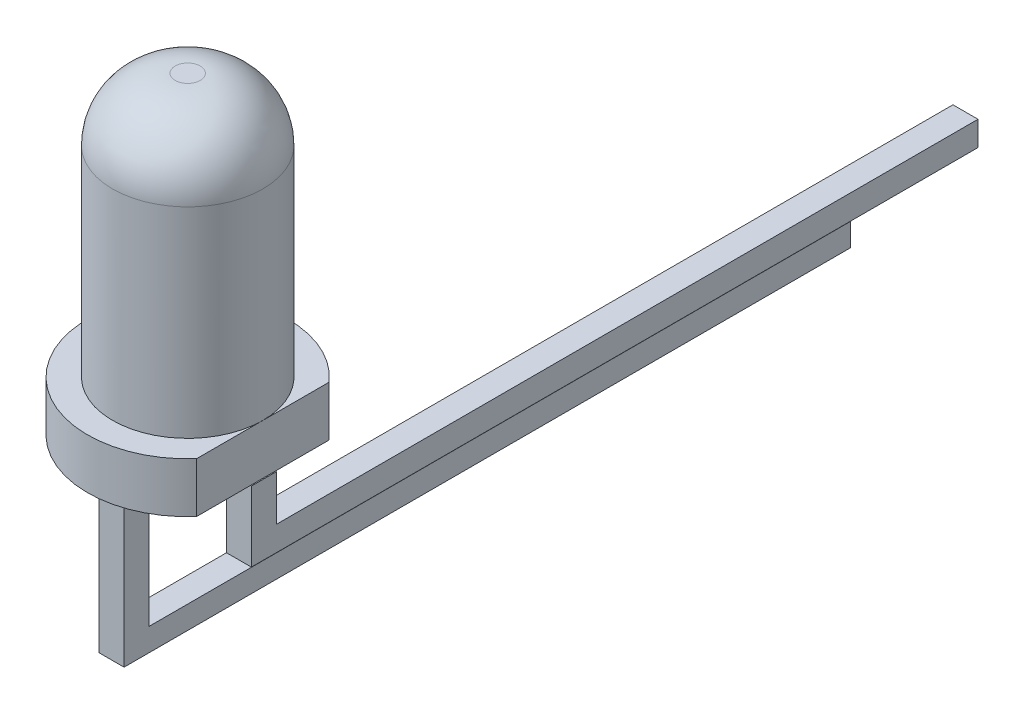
SolidWorks part; units mm, degrees
ref_plane "Alzado" through (0, 0, 0) normal (0, 0, 1) x (1, 0, 0)
ref_plane "Planta" through (0, 0, 0) normal (0, 1, 0) x (1, 0, 0)
ref_plane "Vista lateral" through (0, 0, 0) normal (1, 0, 0) x (0, 0, -1)
sketch "Croquis1" plane through (0, 0, 0) normal (0, 1, 0) x (1, 0, 0)
  circle A0 centre (0, 0) radius 2
  dimension "D1" = 4
extrude "Base" add sketch "Croquis1" along normal blind 1
sketch "Croquis2" plane through (0, 1, 0) normal (0, 1, 0) x (1, 0, 0)
  circle A0 centre (0, 0) radius 1.5
  dimension "D1" = 3
extrude "Cuerpo del LED" add sketch "Croquis2" along normal blind 5.25
sketch "Croquis3" plane through (0, 0, 0) normal (0, -1, 0) x (1, 0, 0)
  line L0 (-1.2701, 0) -> (0, 0) construction
  line L1 (0, 0) -> (1.2702, 0) construction
  line L2 (-1.5201, -0.25) -> (-1.0201, 0.25) construction
  line L3 (-1.5201, -0.25) -> (-1.0201, -0.25)
  line L4 (-1.5201, -0.25) -> (-1.5201, 0.25)
  line L5 (-1.5201, 0.25) -> (-1.0201, 0.25)
  line L6 (-1.0201, -0.25) -> (-1.0201, 0.25)
  line L7 (1.0202, -0.25) -> (1.5202, 0.25) construction
  line L8 (1.0202, -0.25) -> (1.5202, -0.25)
  line L9 (1.0202, -0.25) -> (1.0202, 0.25)
  line L10 (1.0202, 0.25) -> (1.5202, 0.25)
  line L11 (1.5202, -0.25) -> (1.5202, 0.25)
  dimension "D1" = 0.5
  dimension "D2" = 0.5
  dimension "D3" = 0.5
  dimension "D4" = 0.5
extrude "Pines" add sketch "Croquis3" along normal blind 1.4
fillet "Redondeo a Anodo" [suppressed] radius 0.5
fillet "Redondeo a Catodo" [suppressed] radius 0.5
sketch "Croquis6" plane through (0, 1, 0) normal (0, 1, 0) x (1, 0, 0)
  line L0 (2, 0) -> (1.5, 0) construction
  line L1 (1.5, 2.7304) -> (1.5, -1.7696)
  line L2 (1.5, -1.7696) -> (2.5, -1.7696)
  line L3 (2.5, -1.7696) -> (2.5, 2.7304)
  line L4 (2.5, 2.7304) -> (1.5, 2.7304)
  circle A0 centre (0, 0) radius 2 construction
  circle A1 centre (0, 0) radius 1.5 construction
  dimension "D1" = 4.5
  dimension "D2" = 1
extrude "Ranura" cut sketch "Croquis6" against normal up to surface (1 mm away)
fillet "Punta del Led" radius 1.25
other "PropertyManager"
sketch "Sketch1" plane through (0, 0, -0.25) normal (0, 0, -1) x (-1, 0, 0)
  line L0 (-1.0202, -0.9104) -> (-1.5202, -0.9104)
  line L2 (-1.5202, -0.9104) -> (-1.5202, -1.4)
  line L3 (-1.5202, -1.4) -> (-1.5202, 0) construction
  line L5 (-1.0202, 0) -> (-1.5, 0)
  line L6 (-1.5, 0) -> (-1.5202, 0)
  line L7 (-1.5202, 0) -> (-1.5202, -1.4)
  line L8 (-1.5202, -1.4) -> (-1.0202, -1.4)
  line L9 (-1.0202, -1.4) -> (-1.0202, 0)
  line L11 (-1.5, 0) -> (-1.5202, 0)
  line L13 (-1.5202, -1.4) -> (-1.0202, -1.4)
  line L14 (-1.0202, -1.4) -> (-1.0202, -0.9104)
  dimension "D1" = 0
extrude "Boss-Extrude1" add sketch "Sketch1" along normal blind 14 contours L2 L13 L14 L0
ref_plane "Plane1" through (-1.0201, -1.4, -0.25) normal (0, 0, 1) x (1, 0, 0)
sketch "Sketch4" plane through (0, -1.4, 0) normal (0, -1, 0) x (1, 0, 0)
  line L4 (-1.5201, 0.25) -> (-1.5201, -0.25)
  line L5 (-1.5201, -0.25) -> (-1.0201, -0.25)
  line L6 (-1.0201, -0.25) -> (-1.0201, 0.25)
  line L7 (-1.0201, 0.25) -> (-1.5201, 0.25)
  line L8 (-1.5201, 0.25) -> (-1.5201, -0.25)
  line L9 (-1.5201, -0.25) -> (-1.0201, -0.25)
  line L10 (-1.0201, -0.25) -> (-1.0201, 0.25)
  line L11 (-1.0201, 0.25) -> (-1.5201, 0.25)
  dimension "D1" = 0
extrude "Boss-Extrude2" add sketch "Sketch4" along normal blind 3
sketch "Sketch5" plane through (0, 0, -0.25) normal (0, 0, -1) x (-1, 0, 0)
  line L0 (1.0201, -3.9439) -> (1.5201, -3.9439)
  line L4 (1.5201, 0) -> (1.0201, 0)
  line L5 (1.0201, 0) -> (1.0201, -4.4)
  line L6 (1.0201, -4.4) -> (1.5201, -4.4)
  line L7 (1.5201, -4.4) -> (1.5201, 0)
  line L9 (1.0201, -3.9439) -> (1.0201, -4.4)
  line L10 (1.0201, -4.4) -> (1.5201, -4.4)
  line L11 (1.5201, -4.4) -> (1.5201, -3.9439)
  dimension "D1" = 0
extrude "Boss-Extrude3" add sketch "Sketch5" along normal blind 14
